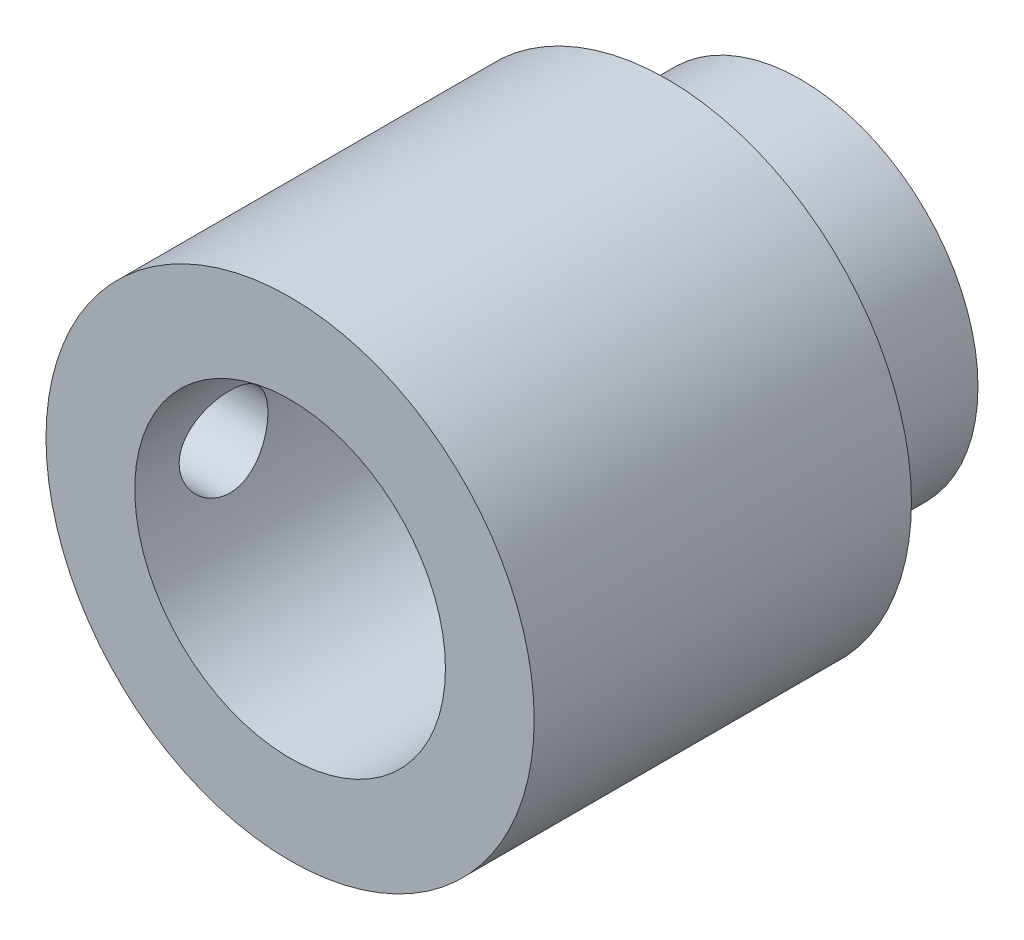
SolidWorks part; units mm, degrees
ref_plane "Face" through (0, 0, 0) normal (0, 0, 1) x (1, 0, 0)
ref_plane "Dessus" through (0, 0, 0) normal (0, 1, 0) x (1, 0, 0)
ref_plane "Droite" through (0, 0, 0) normal (1, 0, 0) x (0, 0, -1)
sketch "Esquisse1" plane through (0, 0, 0) normal (0, 0, 1) x (1, 0, 0)
  circle A0 centre (0, 0) radius 5.5
  dimension "D1" = 11
extrude "Extrusion1" add sketch "Esquisse1" along normal blind 8.5
hole_wizard "Trou taraudé M8x1.01" positions "Esquisse3" profile "Esquisse2" tap size "M8x1.0" standard "ISO"
sketch "Esquisse3" plane through (0, 0, 8.5) normal (0, 0, 1) x (1, 0, 0)
  circle A0 centre (0, 0) radius 5.5 construction
  point P0 (0, 0)
sketch "Esquisse2" plane through (0, 0, 8.5) normal (1, 0, 0) x (0, -1, 0)
  line L0 (0, 0) -> (0, 8)
  line L1 (0, 8) -> (3.5, 8)
  line L2 (3.5, 8) -> (3.5, 0)
  line L5 (3.5, 0) -> (0, 0)
  line L10 (0, 8) -> (-3.5, 8) construction
  line L11 (0, -6.35) -> (0, 107.95) construction
  dimension "Diamètre du trou pour taraudage" = 7
  dimension "Profondeur du trou pour taraudage" = 8
  dimension "Angle de pointe" = 180
sketch "Esquisse4" plane through (0, 0, 0) normal (0, 0, -1) x (-1, 0, 0)
  circle A0 centre (0, 0) radius 4
  dimension "D1" = 8
extrude "Extrusion2" add sketch "Esquisse4" along normal blind 3
sketch "Esquisse5" plane through (0, 0, -3) normal (0, 0, -1) x (-1, 0, 0)
  circle A0 centre (0, 0) radius 2.75
  dimension "D1" = 5.5
extrude "Enlèv. mat.-Extru.1" cut sketch "Esquisse5" against normal blind 0.9
sketch "Esquisse6" plane through (0, 0, -2.1) normal (0, 0, -1) x (-1, 0, 0)
  circle A0 centre (0, 0) radius 2
  dimension "D1" = 4
extrude "Enlèv. mat.-Extru.2" cut sketch "Esquisse6" against normal through all
sketch "Esquisse7" plane through (0, 0, 0) normal (1, 0, 0) x (0, 0, -1)
  line L0 (-8.5, 5.5) -> (-8.5, -5.5) construction
  circle A0 centre (-6.5, 0) radius 1
  dimension "D1" = 2
  dimension "D2" = 2
extrude "Enlèv. mat.-Extru.3" cut sketch "Esquisse7" against normal through all
